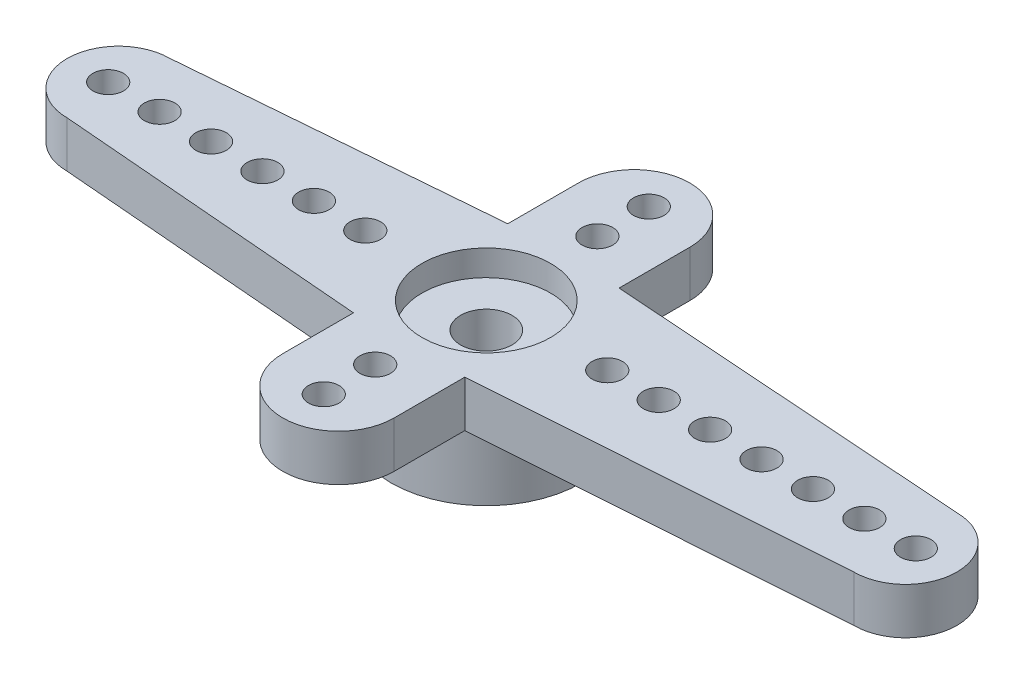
SolidWorks part; units mm, degrees
ref_plane "Alzado" through (0, 0, 0) normal (0, 0, 1) x (1, 0, 0)
ref_plane "Planta" through (0, 0, 0) normal (0, 1, 0) x (1, 0, 0)
ref_plane "Vista lateral" through (0, 0, 0) normal (1, 0, 0) x (0, 0, -1)
sketch "Croquis1" plane through (0, 0, 0) normal (0, 1, 0) x (1, 0, 0)
  circle A0 centre (0, 0) radius 3.7
  dimension "D1" = 7.4
extrude "Saliente-Extruir2" add sketch "Croquis1" along normal blind 4.3 contours A0
sketch "Croquis2" plane through (0, 0, 0) normal (0, -1, 0) x (1, 0, 0)
  circle A0 centre (0, 0) radius 2.5
  dimension "D1" = 5
extrude "Cortar-Extruir1" cut sketch "Croquis2" against normal blind 1.5
sketch "Croquis3" plane through (0, 4.3, 0) normal (0, 1, 0) x (1, 0, 0)
  circle A0 centre (0, 0) radius 2.5
  dimension "D1" = 5
extrude "Cortar-Extruir2" cut sketch "Croquis3" against normal blind 1
sketch "Croquis4" plane through (0, 3.3, 0) normal (0, 1, 0) x (1, 0, 0)
  circle A0 centre (0, 0) radius 1
  dimension "D1" = 2
extrude "Cortar-Extruir3" cut sketch "Croquis4" against normal blind 1.8
sketch "Croquis5" plane through (0, 4.3, 0) normal (0, 1, 0) x (1, 0, 0)
  line L0 (0, 0) -> (-2.1656, 0) construction
  line L1 (-2.1656, 3) -> (-3.1202, 0)
  line L2 (-3.1202, 0) -> (-2.1656, -3)
  line L3 (-2.1656, 0) -> (-2.5, 0) construction
  line L4 (-3.7, 0) -> (-16.3, 0) construction
  line L5 (-14.3, 0) -> (-14.3, 2) construction
  line L6 (-14.3, 0) -> (-14.3, -2) construction
  line L7 (-2.1656, 3) -> (-14.3, 2)
  line L8 (-2.1656, -3) -> (-14.3, -2)
  line L9 (0, 5.1944) -> (0, -4.3435) construction
  line L10 (3.1202, 0) -> (2.1656, -3)
  line L11 (2.1656, 3) -> (16.3, 2)
  line L12 (2.1656, -3) -> (16.3, -2)
  line L13 (2.1656, 3) -> (3.1202, 0)
  line L14 (3.7, 0) -> (18.3, 0) construction
  line L15 (16.3, 0) -> (16.3, 2) construction
  line L16 (16.3, 0) -> (16.3, -2) construction
  arc A0 (-14.3, 2) -> (-14.3, -2) centre (-14.3, 0) ccw
  arc A1 (16.3, 2) -> (16.3, -2) centre (16.3, 0) cw
  circle A3 centre (0, 0) radius 3.7 construction
  circle A4 centre (0, 0) radius 2.5 construction
  point P2 (-14.3, 0)
  point P30 (16.3, 0)
  dimension "D1" = 2.1656
  dimension "D2" = 12.6
  dimension "D3" = 2
  dimension "D4" = 2
  dimension "D5" = 2
  dimension "D6" = 14.6
  dimension "D7" = 2
extrude "Saliente-Extruir3" add sketch "Croquis5" against normal blind 1.8
sketch "Croquis6" plane through (0, 4.3, 0) normal (0, 1, 0) x (1, 0, 0)
  line L0 (0, 0) -> (-16.3, 0) construction
  line L1 (2, 0) -> (-14.3, 0) construction
  line L2 (4, 0) -> (-12.3, 0) construction
  line L3 (6, 0) -> (-10.3, 0) construction
  line L4 (8, 0) -> (-8.3, 0) construction
  line L5 (10, 0) -> (-6.3, 0) construction
  line L6 (0, 5.4913) -> (0, -4.5375) construction
  arc A0 (-14.3, 2) -> (-14.3, -2) centre (-14.3, 0) ccw construction
  circle A1 centre (-14.705, 0) radius 0.595
  circle A2 centre (-12.705, 0) radius 0.595
  circle A3 centre (-10.705, 0) radius 0.595
  circle A4 centre (-8.705, 0) radius 0.595
  circle A5 centre (-6.705, 0) radius 0.595
  circle A6 centre (-4.705, 0) radius 0.595
  circle A7 centre (14.705, 0) radius 0.595
  circle A8 centre (12.705, 0) radius 0.595
  circle A9 centre (10.705, 0) radius 0.595
  circle A10 centre (8.705, 0) radius 0.595
  circle A11 centre (6.705, 0) radius 0.595
  circle A12 centre (4.705, 0) radius 0.595
  circle A13 centre (16.705, 0) radius 0.595
  point P6 (-14.705, 0)
  dimension "D2" = 1.19
  dimension "D1" = 1.595
  dimension "D3" = 6
  dimension "D4" = 2
extrude "Cortar-Extruir4" cut sketch "Croquis6" against normal blind 1.8
sketch "Croquis7" plane through (0, 4.3, 0) normal (0, 1, 0) x (1, 0, 0)
  line L0 (-2.1656, 3) -> (2.1656, 3)
  line L1 (2.1656, 3) -> (2.1656, 5.75)
  line L2 (-2.1656, 3) -> (-2.1656, 5.75)
  line L3 (-16.3, 0) -> (18.3, 0) construction
  line L4 (0, 7.9156) -> (0, 6.3206) construction
  line L7 (0, 5.9156) -> (0, 4.3206) construction
  line L8 (2.1656, -3) -> (2.1656, -5.75)
  line L9 (-2.1656, -3) -> (-2.1656, -5.75)
  line L10 (-2.1656, -3) -> (2.1656, -3)
  line L11 (10, 7.9156) -> (10, 6.3206) construction
  line L12 (10, 5.9156) -> (10, 4.3206) construction
  arc A0 (2.1656, 5.75) -> (-2.1656, 5.75) centre (0, 5.75) ccw
  arc A1 (-14.3, 2) -> (-14.3, -2) centre (-14.3, 0) ccw construction
  arc A2 (16.3, -2) -> (16.3, 2) centre (16.3, 0) ccw construction
  circle A3 centre (0, 6.3206) radius 0.595
  circle A6 centre (0, 4.3206) radius 0.595
  circle A7 centre (0, -4.3206) radius 0.595
  circle A8 centre (0, -6.3206) radius 0.595
  arc A9 (2.1656, -5.75) -> (-2.1656, -5.75) centre (0, -5.75) cw
  circle A10 centre (10, 6.3206) radius 0.595
  circle A11 centre (10, 4.3206) radius 0.595
  dimension "D2" = 1.595
  dimension "D3" = 1.19
  dimension "D1" = 2.75
  dimension "D4" = 2
  dimension "D5" = 2
extrude "Saliente-Extruir4" add sketch "Croquis7" against normal blind 1.8
